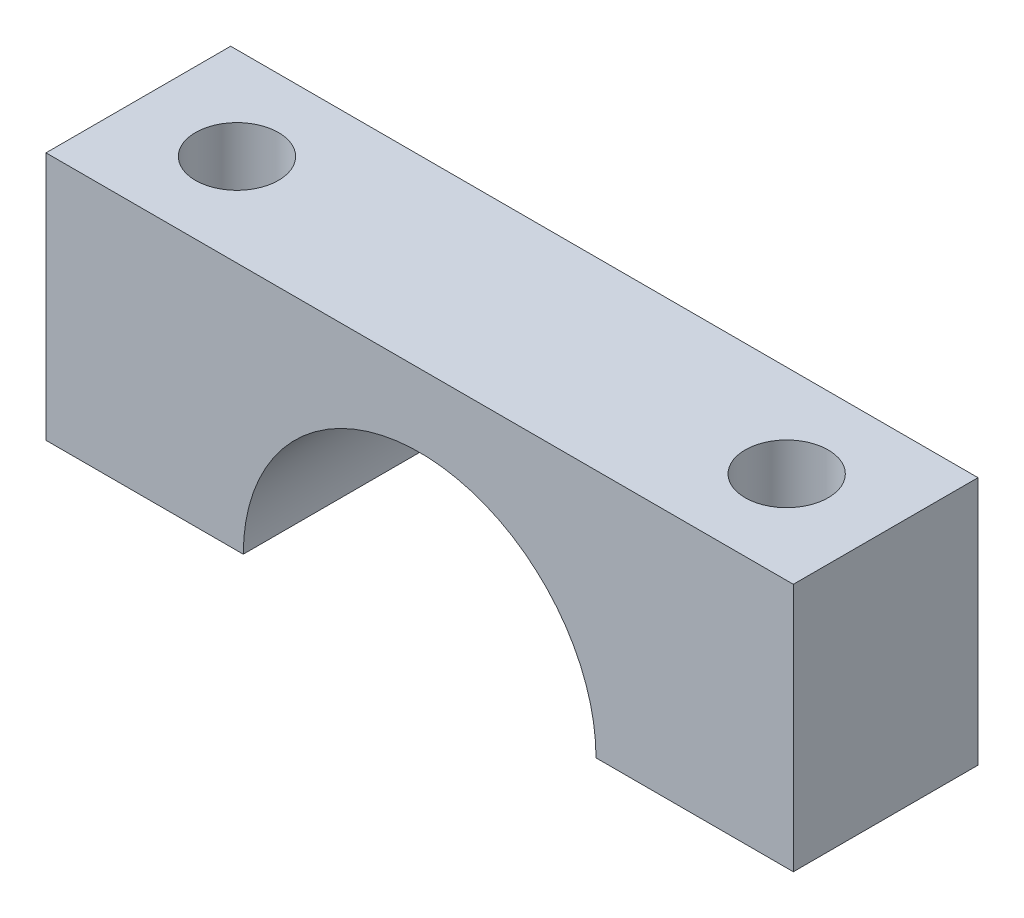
SolidWorks part; units mm, degrees
ref_plane "Plan de face" through (0, 0, 0) normal (0, 0, 1) x (1, 0, 0)
ref_plane "Plan de dessus" through (0, 0, 0) normal (0, 1, 0) x (1, 0, 0)
ref_plane "Plan de droite" through (0, 0, 0) normal (1, 0, 0) x (0, 0, -1)
sketch "Esquisse2" plane through (0, 0, 0) normal (0, 0, 1) x (1, 0, 0)
  line L0 (0, 0) -> (0, 60)
  line L1 (0, 60) -> (180.08, 60)
  line L2 (180.08, 60) -> (180.08, 0)
  line L3 (180.08, 0) -> (132.54, 0)
  line L4 (0, 0) -> (47.54, 0)
  arc A0 (132.54, 0) -> (47.54, 0) centre (90.04, 0) ccw
  dimension "D4" = 42.5
  dimension "D1" = 60
  dimension "D2" = 47.54
  dimension "D3" = 47.54
extrude "Extrusion1" add sketch "Esquisse2" along normal blind 44.5
hole_wizard "Chambrage pour vis à tête hexagonale M81" positions "Esquisse4" profile "Esquisse5" counterbore size "M8" standard "ISO"
sketch "Esquisse4" plane through (0, 60, 0) normal (0, 1, 0) x (-1, 0, 0)
  line L0 (-180.08, 0) -> (0, 0) construction
  line L1 (0, 44.5) -> (0, 0) construction
  point P0 (-23.77, 22.25)
  point P4 (0, 22.25)
  dimension "D1" = 22.25
  dimension "D2" = 23.77
sketch "Esquisse5" plane through (23.77, 60, 22.25) normal (1, 0, 0) x (0, 0, 1)
  line L0 (0, 0) -> (0, 60)
  line L1 (0, 60) -> (4.5, 60)
  line L3 (4.5, 60) -> (4.5, 18)
  line L4 (4.5, 18) -> (10, 18)
  line L5 (10, 18) -> (10, 0)
  line L7 (10, 0) -> (0, 0)
  line L11 (0, -6.35) -> (0, 107.95) construction
  dimension "Diamètre du perçage jusqu'au prochain" = 9
  dimension "Profondeur du perçage jusqu'au prochain" = 60
  dimension "Diamètre du chambrage" = 20
  dimension "Profondeur du chambrage" = 18
pattern_linear "Répétition linéaire1" count 2 spacing 132.46 along (1, 0, 0) of "Chambrage pour vis à tête hexagonale M81"
ref_plane "Plan1" through (0, 0, 22.25) normal (0, 0, 1) x (1, 0, 0)
sketch "Esquisse6" plane through (0, 0, 22.25) normal (0, 0, 1) x (1, 0, 0)
  line L0 (71.4448, 39.8775) -> (72.0787, 38.5181)
  line L1 (108.6352, 39.8775) -> (108.0013, 38.5181)
  line L2 (90.04, 80.3246) -> (90.04, -11.2276) construction
  arc A0 (108.6352, 39.8775) -> (71.4448, 39.8775) centre (90.04, 0) ccw
  arc A1 (132.54, 0) -> (47.54, 0) centre (90.04, 0) ccw construction
  arc A3 (108.0013, 38.5181) -> (72.0787, 38.5181) centre (90.04, 0) ccw
  dimension "D1" = 88
  dimension "D2" = 25
  dimension "D3" = 50
extrude "Enlèv. mat.-Extru.1" cut sketch "Esquisse6" against normal blind 5 and the other way blind 5
